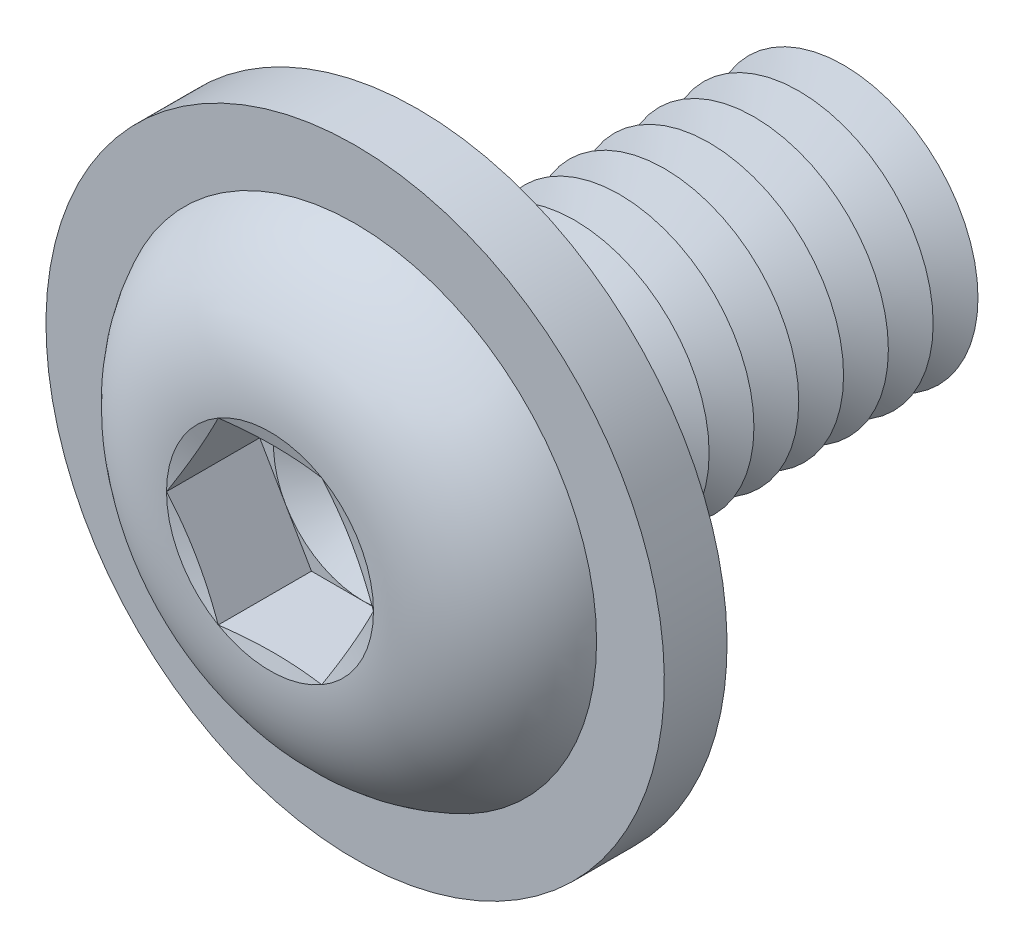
SolidWorks part; units mm, degrees
ref_plane "Front Plane" through (0, 0, 0) normal (0, 0, 1) x (1, 0, 0)
ref_plane "Top Plane" through (0, 0, 0) normal (0, 1, 0) x (1, 0, 0)
ref_plane "Right Plane" through (0, 0, 0) normal (1, 0, 0) x (0, 0, -1)
sketch "Sketch1" plane through (0, 0, 0) normal (1, 0, 0) x (0, 0, -1)
  line L0 (0, 1.5) -> (0, 2.85)
  line L3 (0, 1.5) -> (5, 1.5)
  line L4 (5, 1.5) -> (5, 0)
  line L5 (5, 0) -> (-1.65, 0) construction
  line L6 (-1.65, 0) -> (5, 0)
  line L7 (-1.65, 1.1547) -> (-1.65, 0.5773) construction
  line L8 (-1.65, 0.5773) -> (-1.65, 0)
  line L9 (-1.65, 1.1547) -> (-1.4953, 0.5773)
  line L10 (-1.4953, 0.5773) -> (-1.65, 0.5773)
  line L11 (5, 0) -> (22.7481, 0) construction
  line L12 (0, 2.85) -> (-1.65, 2.85) construction
  arc A1 (0, 2.85) -> (-1.65, 1.1547) centre (0, 1.1994) ccw
  point P8 (5, 0.75)
  dimension "D1" = 5.7
  dimension "D2" = 3
  dimension "D3" = 1.65
  dimension "D4" = 2.3094
  dimension "D5" = 5
  dimension "D6" = 15
revolve "Revolve1" add sketch "Sketch1" angle 360 about L5
fillet "Fillet1" radius 0.25 1 edges at (-1.5, 0, 0)
sketch "Sketch2" plane through (0, 0, 0) normal (1, 0, 0) x (0, 0, -1)
  line L0 (4.75, 1.5) -> (5.25, 1.5)
  line L1 (5, 1.5) -> (0.25, 1.5) construction
  line L2 (5.25, 1.5) -> (5, 1.067)
  line L3 (5, -1.5) -> (5, 1.5) construction
  line L4 (5, 1.067) -> (4.75, 1.5)
  dimension "D1" = 0.5
revolve "Cut-Revolve1" cut sketch "Sketch2" angle 360 about axis through (0, 0, -5) along (0, 0, -1)
pattern_linear "LPattern1" count 10 spacing 0.5 along (0, 0, 1) of "Cut-Revolve1"
sketch "Sketch3" plane through (0, 0, 1.65) normal (0, 0, 1) x (1, 0, 0)
  line L7 (0.5773, 1) -> (-0.5774, 1)
  line L8 (-0.5774, 1) -> (-1.1547, 0)
  line L9 (-1.1547, 0) -> (-0.5773, -1)
  line L10 (-0.5773, -1) -> (0.5773, -1)
  line L11 (0.5773, -1) -> (1.1547, 0)
  line L12 (1.1547, 0) -> (0.5773, 1)
  circle A0 centre (0, 0) radius 1 construction
  circle A3 centre (0, 0) radius 1.1547 construction
extrude "Cut-Extrude1" cut sketch "Sketch3" against normal blind 1.04
sketch "Sketch4" plane through (0, 0, 0.61) normal (0, 0, 1) x (1, 0, 0)
  line L1 (0.5773, 1) -> (-0.5774, 1) construction
  circle A0 centre (0, 0) radius 1
extrude "Cut-Extrude2" cut sketch "Sketch4" against normal through all draft 60
sketch "Sketch5" plane through (0, 0, 0) normal (0, 0, -1) x (-1, 0, 0)
  circle A0 centre (0, 0) radius 3.45
  circle A1 centre (0, 0) radius 1.75
  circle A2 centre (0, 0) radius 1.75 construction
  dimension "D1" = 6.9
extrude "Boss-Extrude1" add sketch "Sketch5" against normal blind 0.7
